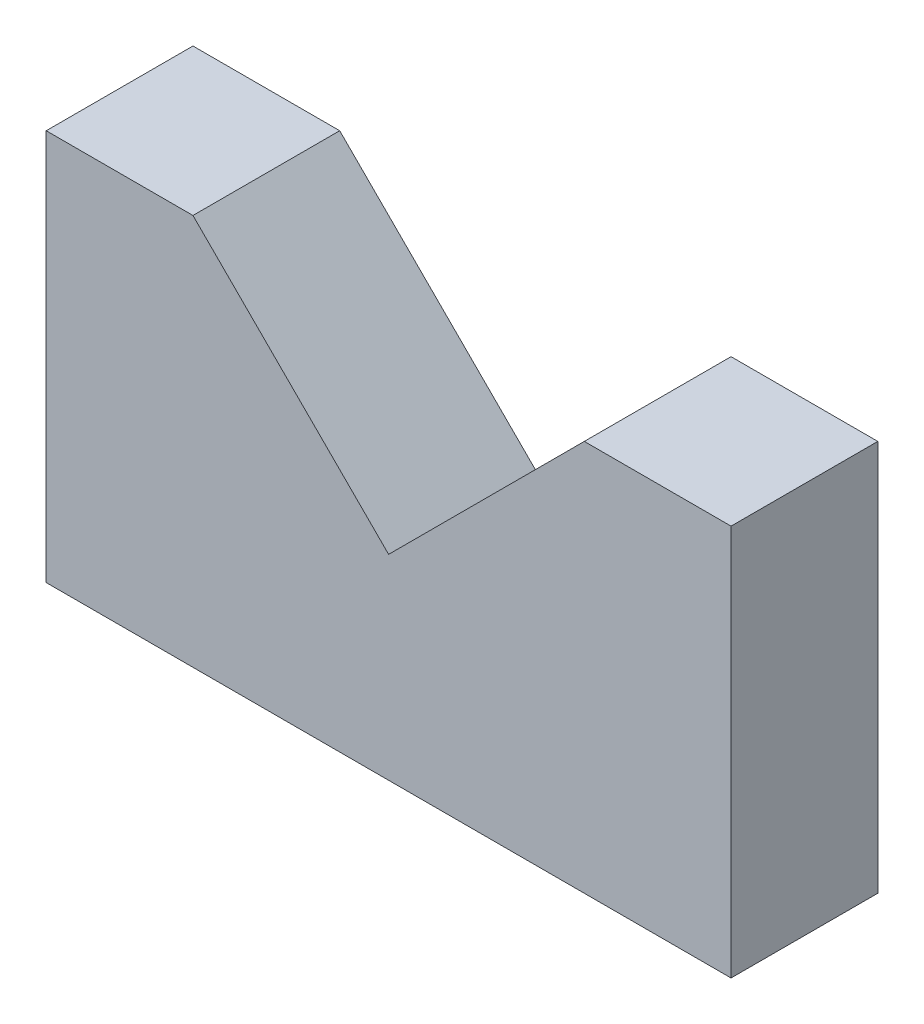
SolidWorks part; units mm, degrees
ref_plane "Plan de face" through (0, 0, 0) normal (0, 0, 1) x (1, 0, 0)
ref_plane "Plan de dessus" through (0, 0, 0) normal (0, 1, 0) x (1, 0, 0)
ref_plane "Plan de droite" through (0, 0, 0) normal (1, 0, 0) x (0, 0, -1)
sketch "Esquisse1" plane through (0, 0, 0) normal (0, 0, 1) x (1, 0, 0)
  line L0 (0, 0) -> (0, 40)
  line L1 (0, 40) -> (15, 40)
  line L2 (15, 40) -> (35, 20)
  line L3 (35, 20) -> (55, 40)
  line L4 (55, 40) -> (70, 40)
  line L5 (70, 40) -> (70, 0)
  line L6 (70, 0) -> (0, 0)
  dimension "D1" = 70
  dimension "D2" = 40
  dimension "D3" = 90
  dimension "D4" = 40
  dimension "D5" = 15
  dimension "D6" = 15
  dimension "D7" = 20
extrude "Extrusion1" add sketch "Esquisse1" along normal blind 15
